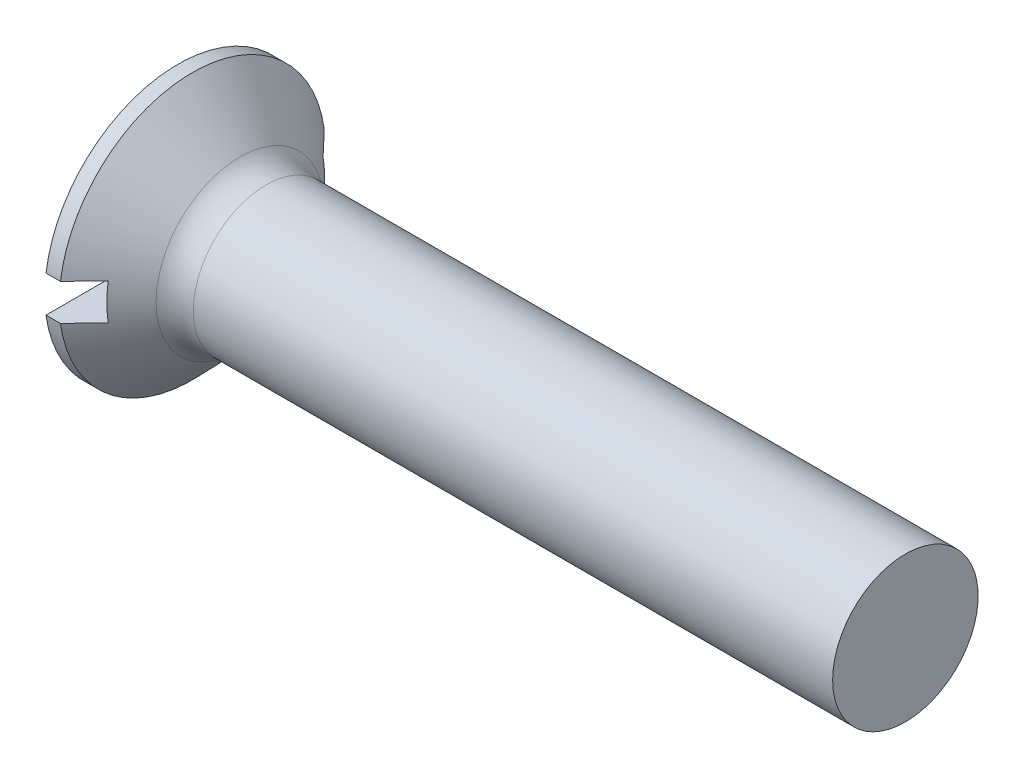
SolidWorks part; units mm, degrees
ref_plane "Plane1" through (0, 0, 0) normal (0, 0, 1) x (1, 0, 0)
ref_plane "Plane2" through (0, 0, 0) normal (0, 1, 0) x (1, 0, 0)
ref_plane "Plane3" through (0, 0, 0) normal (1, 0, 0) x (0, 0, -1)
sketch "BodySke" plane through (0, 0, 0) normal (0, 0, 1) x (1, 0, 0)
  line L0 (0, 0) -> (0, 9.15)
  line L1 (0, 9.15) -> (0.9924, 9.15)
  line L2 (5, 5) -> (50, 5)
  line L3 (50, 5) -> (50, 0)
  line L4 (50, 0) -> (0, 0)
  line L5 (-6.35, 0) -> (82.55, 0) construction
  line L6 (5, -5) -> (50, -5) construction
  line L7 (0.9924, -9.15) -> (5, -5) construction
  line L8 (0.9924, 9.15) -> (5, 5)
  line L9 (0, -9.15) -> (0.9924, -9.15) construction
  line L10 (6.5, 6.5875) -> (6.5, -2.9375) construction
  line L11 (0, 6.35) -> (0, -3.175) construction
  dimension "Diameter" = 10
  dimension "Length" = 50
  dimension "Head_ht" = 5
  dimension "Head_dia" = 18.3
  dimension "Head_ang" = 92
  dimension "D6" = 0.9924
  dimension "Advance" = 1.5
  dimension "Thread_nom" = 50
revolve "Base-Revolve" add sketch "BodySke" angle 360 about L5
fillet "Fillet1" radius 2.5 1 edges at (5, 0, 5)
sketch "Sketch2" plane through (0, 0, 0) normal (-1, 0, 0) x (0, 0, 1)
  line L0 (-9.15, -1.25) -> (9.15, -1.25)
  line L1 (-9.15, -1.25) -> (-9.15, 1.25)
  line L2 (9.15, 1.25) -> (-9.15, 1.25)
  line L3 (9.15, 1.25) -> (9.15, -1.25)
  dimension "D1" = 1.25
  dimension "Slot_width" = 2.5
  dimension "D2" = 18.3
  dimension "D3" = 9.15
extrude "Slot" cut sketch "Sketch2" against normal blind 2.6
sketch "ThdSchSke" plane through (0, 0, 0) normal (0, 0, 1) x (1, 0, 0)
  line L0 (6.5, -3.9624) -> (5.7735, -5)
  line L1 (6.5, -3.9624) -> (7.2265, -5)
  line L2 (7.2265, -5) -> (7.2265, -6.25)
  line L3 (-3.175, 0) -> (5.1513, 0) construction
  line L5 (7.2265, -6.25) -> (5.7735, -6.25)
  line L6 (5.7735, -6.25) -> (5.7735, -5)
  line L7 (0, 9.15) -> (0, 1.25) construction
  dimension "Thread_minor" = 7.9248
  dimension "Diameter" = 10
  dimension "Start" = 6.5
  dimension "SideAngle" = 55
  dimension "VeeAngle" = 70
  dimension "Overcut" = 12.5
revolve "ThreadSchematic" [suppressed] cut sketch "ThdSchSke" angle 360 about L3
pattern_linear "ThdSchPat" [suppressed]
equation "\"D1@Sketch2\" = \"Slot_width@Sketch2\" / 2"
equation "\"D2@Sketch2\" = \"Head_dia@BodySke\""
equation "\"D3@Sketch2\" = \"D2@Sketch2\" / 2"
equation "\"Thread_length@ThreadCosmetic\" = ((sgn( (\"Length@BodySke\" - \"Advance@BodySke\" * 1.0 - \"Head_ht@BodySke\" ) - \"Thread_nom@BodySke\" )-1)*( (\"Length@BodySke\" - \"Advance@BodySke\" * 1.0 - \"Head_ht@BodySke\" "
equation "\"Thread_minor@ThdSchSke\" = \"Thread_minor@ThreadCosmetic\""
equation "\"Diameter@ThdSchSke\" = \"Diameter@BodySke\""
equation "\"Overcut@ThdSchSke\" = \"Diameter@BodySke\" * 1.25"
equation "\"Start@ThdSchSke\" = 0.000001 + \"Length@BodySke\" - \"Thread_length@ThreadCosmetic\"  '---Countersunk---"
equation "\"Num_threads@ThdSchPat\" = int( \"Thread_length@ThreadCosmetic\" / \"Advance@BodySke\" + 0.999 )  + 1"
equation "\"Advance@ThdSchPat\" = \"Thread_length@ThreadCosmetic\" /  (\"Num_threads@ThdSchPat\" - 1) 'relax it"
